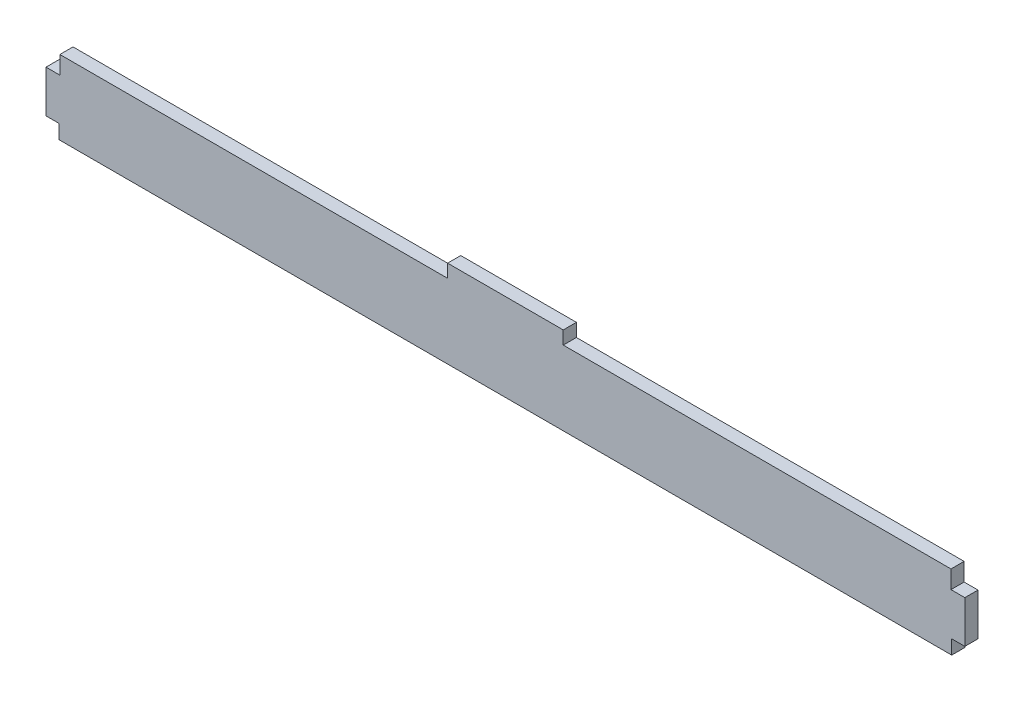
SolidWorks part; units mm, degrees
ref_plane "Front Plane" through (0, 0, 0) normal (0, 0, 1) x (1, 0, 0)
ref_plane "Top Plane" through (0, 0, 0) normal (0, 1, 0) x (1, 0, 0)
ref_plane "Right Plane" through (0, 0, 0) normal (1, 0, 0) x (0, 0, -1)
sketch "Sketch1" plane through (0, 0, 0) normal (0, 0, 1) x (1, 0, 0)
  line L0 (111.1599, -1.524) -> (111.1599, 0)
  line L1 (111.1599, 0) -> (124.5657, 0)
  line L2 (124.5657, 0) -> (124.5657, -1.524)
  line L3 (124.5657, -1.524) -> (169.5117, -1.524)
  line L4 (169.5117, -1.524) -> (169.5117, -3.5995)
  line L5 (169.5117, -3.5995) -> (171.1214, -3.5995)
  line L6 (117.8628, 0) -> (117.8628, -84.3108) construction
  line L7 (66.2139, -3.5995) -> (64.6041, -3.5995)
  line L8 (66.2139, -1.524) -> (66.2139, -3.5995)
  line L9 (111.1599, -1.524) -> (66.2139, -1.524)
  line L10 (64.6041, -3.5995) -> (64.6041, -8.4953)
  line L11 (64.6041, -8.4953) -> (66.1281, -8.4953)
  line L12 (66.1281, -8.4953) -> (66.1281, -10.1332)
  line L13 (66.1281, -10.1332) -> (169.5974, -10.1332)
  line L14 (169.5974, -8.4953) -> (169.5974, -10.1332)
  line L15 (171.1214, -8.4953) -> (169.5974, -8.4953)
  line L16 (171.1214, -3.5995) -> (171.1214, -8.4953)
  point P24 (117.8628, -10.1332)
extrude "Boss-Extrude1" add sketch "Sketch1" along normal blind 1.524
